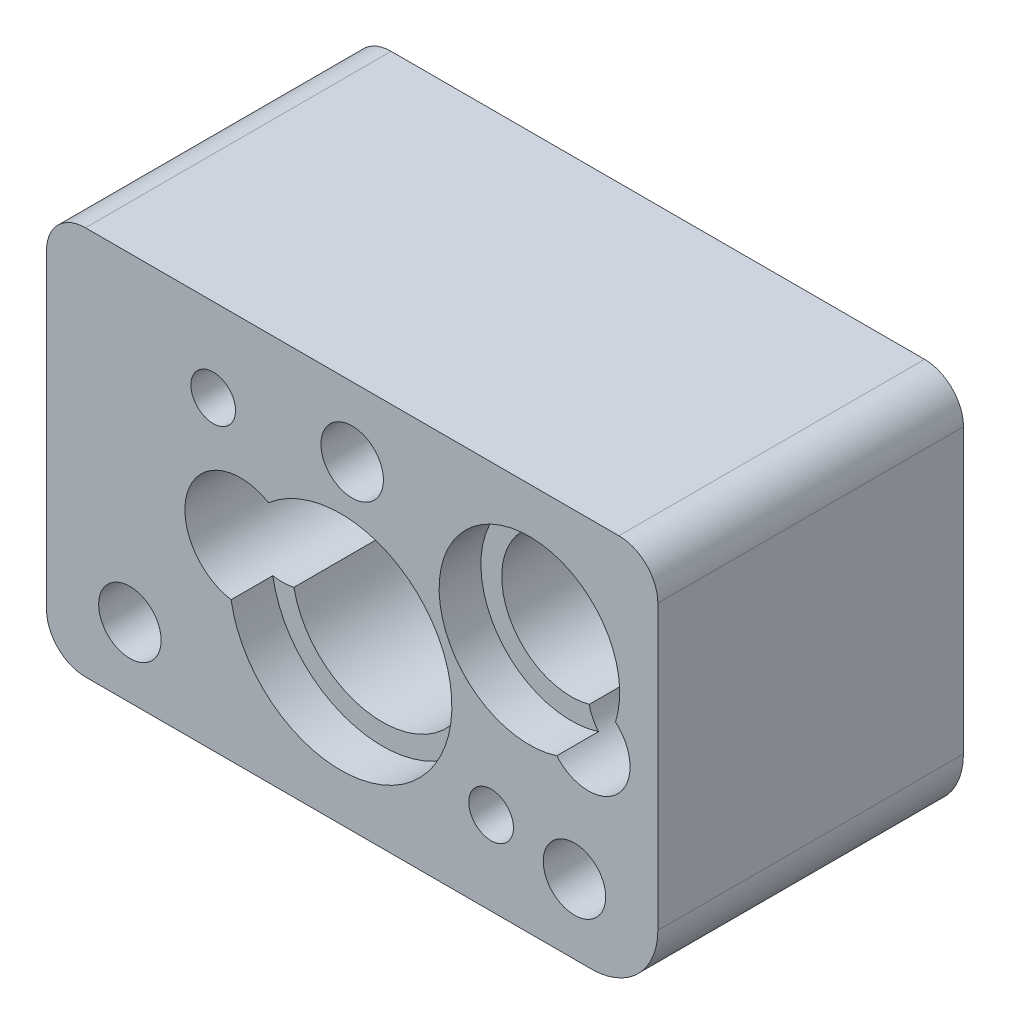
SolidWorks part; units mm, degrees
ref_plane "Front" through (0, 0, 0) normal (0, 0, 1) x (1, 0, 0)
ref_plane "Top" through (0, 0, 0) normal (0, 1, 0) x (1, 0, 0)
ref_plane "Right" through (0, 0, 0) normal (1, 0, 0) x (0, 0, -1)
ref_plane "Plane1"
sketch "Sketch1" plane through (0, 0, 40.2082) normal (0, 0, -1) x (-1, 0, 0)
  line L0 (840.5808, -30.9504) -> (899.6747, -30.9504) construction
  line L4 (837.0883, -8.7254) -> (898.0483, -8.7254)
  line L5 (832.6433, -13.1704) -> (832.6433, -45.5554)
  line L6 (840.2633, -53.1754) -> (898.0483, -53.1754)
  line L7 (902.4933, -13.1704) -> (902.4933, -48.7304)
  circle A0 centre (840.5808, -30.9504) radius 4.7625 construction
  arc A2 (832.6433, -45.5554) -> (840.2633, -53.1754) centre (840.2633, -45.5554) ccw
  arc A3 (898.0483, -8.7254) -> (902.4933, -13.1704) centre (898.0483, -13.1704) cw
  arc A4 (898.0483, -53.1754) -> (902.4933, -48.7304) centre (898.0483, -48.7304) ccw
  arc A5 (837.0883, -8.7254) -> (832.6433, -13.1704) centre (837.0883, -13.1704) ccw
extrude "Boss-Extrude1" add sketch "Sketch1" against normal blind 31.75 and the other way blind 3.175 flip side to cut
hole_wizard "Hole1" positions "Point_Sketch" profile "Profil_Sketch" hole size "Ø0.15" standard "ISO"
sketch "Point_Sketch" plane through (-883.9861, -20.3493, 71.9582) normal (0, 0, -1) x (1, 0, 0)
  point P0 (3.6543, 10.6011)
sketch "Profil_Sketch" plane through (-880.3318, -30.9504, 71.9582) normal (1, 0, 0) x (0, -1, 0)
  line L0 (0, 0) -> (0, 34.925)
  line L1 (0, 34.925) -> (6.35, 34.925)
  line L2 (6.35, 34.925) -> (6.35, 0)
  line L5 (6.35, 0) -> (0, 0)
  line L11 (0, -6.35) -> (0, 107.95) construction
  dimension "Diameter" = 12.7
  dimension "Thru Hole Depth" = 34.925
other "usin_DL090<1>"
hole_wizard "Hole11" positions "Point_Sketch1" profile "Profil_Sketch1" hole size "Ø0.15" standard "ISO"
sketch "Point_Sketch1" plane through (-844.2351, -20.3493, 71.9582) normal (0, 0, -1) x (1, 0, 0)
  point P0 (3.6543, 10.6011)
sketch "Profil_Sketch1" plane through (-840.5808, -30.9504, 71.9582) normal (1, 0, 0) x (0, -1, 0)
  line L0 (0, 0) -> (0, 34.925)
  line L1 (0, 34.925) -> (4.7625, 34.925)
  line L2 (4.7625, 34.925) -> (4.7625, 0)
  line L5 (4.7625, 0) -> (0, 0)
  line L11 (0, -6.35) -> (0, 107.95) construction
  dimension "Diameter" = 9.525
  dimension "Thru Hole Depth" = 34.925
other "usin_DL090<2>"
hole_wizard "Hole12" positions "Point_Sketch2" profile "Profil_Sketch2" counterbore size "1/4" standard "ANSI Inch"
sketch "Point_Sketch2" plane through (-860.1851, -23.2802, 71.9582) normal (0, 0, -1) x (1, 0, 0)
  point P0 (12.8691, 0.935)
sketch "Profil_Sketch2" plane through (-847.316, -24.2152, 71.9582) normal (1, 0, 0) x (0, -1, 0)
  line L0 (0, 0) -> (0, 34.925)
  line L1 (0, 34.925) -> (7.9375, 34.925)
  line L3 (7.9375, 34.925) -> (7.9375, 4.7752)
  line L4 (7.9375, 4.7752) -> (10.3187, 4.7752)
  line L5 (10.3187, 4.7752) -> (10.3187, 0)
  line L7 (10.3187, 0) -> (0, 0)
  line L11 (0, -6.35) -> (0, 107.95) construction
  dimension "Diameter" = 15.875
  dimension "Thru Hole Depth" = 34.925
  dimension "L1" = 4.7752
other "usin_LS160<1>"
hole_wizard "Hole13" positions "Point_Sketch3" profile "Profil_Sketch3" counterbore size "1/4" standard "ANSI Inch"
sketch "Point_Sketch3" plane through (-881.7442, -34.1853, 71.9582) normal (0, 0, -1) x (1, 0, 0)
  point P0 (12.8691, 0.935)
sketch "Profil_Sketch3" plane through (-868.8751, -35.1203, 71.9582) normal (1, 0, 0) x (0, -1, 0)
  line L0 (0, 0) -> (0, 34.925)
  line L1 (0, 34.925) -> (10.3187, 34.925)
  line L3 (10.3187, 34.925) -> (10.3188, 4.7625)
  line L4 (10.3188, 4.7625) -> (12.7, 4.7625)
  line L5 (12.7, 4.7625) -> (12.7, 0)
  line L7 (12.7, 0) -> (0, 0)
  line L11 (0, -6.35) -> (0, 107.95) construction
  dimension "Diameter" = 20.6375
  dimension "Thru Hole Depth" = 34.925
  dimension "L1" = 4.7625
other "usin_LS160<2>"
hole_wizard "Hole14" positions "Point_Sketch4" profile "Profil_Sketch4" counterbore size "1/4" standard "ANSI Inch"
sketch "Point_Sketch4" plane through (-829.2992, -44.3029, 37.0332) normal (0, 0, 1) x (-1, 0, 0)
  point P0 (12.8691, 0.935)
  point P2 (63.6691, 0.935)
  point P4 (38.2691, -27.64)
sketch "Profil_Sketch4" plane through (-842.1683, -45.2379, 37.0332) normal (1, 0, 0) x (0, 1, 0)
  line L0 (0, 0) -> (0, 34.925)
  line L1 (0, 34.925) -> (3.5687, 34.925)
  line L3 (3.5687, 34.925) -> (3.5687, 14.224)
  line L4 (3.5687, 14.224) -> (5.3594, 14.224)
  line L5 (5.3594, 14.224) -> (5.3594, 0)
  line L7 (5.3594, 0) -> (0, 0)
  line L11 (0, -6.35) -> (0, 107.95) construction
  dimension "Diameter" = 7.1374
  dimension "Thru Hole Depth" = 34.925
  dimension "L1" = 14.224
other "usin_LS160_.25-20x1.75-SHCS<3>"
hole_wizard "Hole15" positions "Point_Sketch5" profile "Profil_Sketch5" tap size "1/4-20" standard "ANSI Inch"
sketch "Point_Sketch5" plane through (-865.9068, -34.4826, 71.9582) normal (0, 0, 1) x (1, 0, 0)
  point P0 (14.2135, -9.1678)
  point P2 (-17.5365, 16.2322)
sketch "Profil_Sketch5" plane through (-851.6933, -43.6504, 71.9582) normal (1, 0, 0) x (0, -1, 0)
  line L0 (0, 0) -> (0, 36.4588)
  line L1 (0, 36.4588) -> (2.5527, 34.925)
  line L2 (2.5527, 34.925) -> (2.5527, 0)
  line L5 (2.5527, 0) -> (0, 0)
  line L10 (0, 36.4588) -> (-2.5527, 34.925) construction
  line L11 (0, -6.35) -> (0, 107.95) construction
  dimension "Tap Drill Dia." = 5.1054
  dimension "Tap Drill Depth" = 34.925
  dimension "Drill Angle" = 118
other "usin_DT360_.25-20x.625-SHCS<1>"
